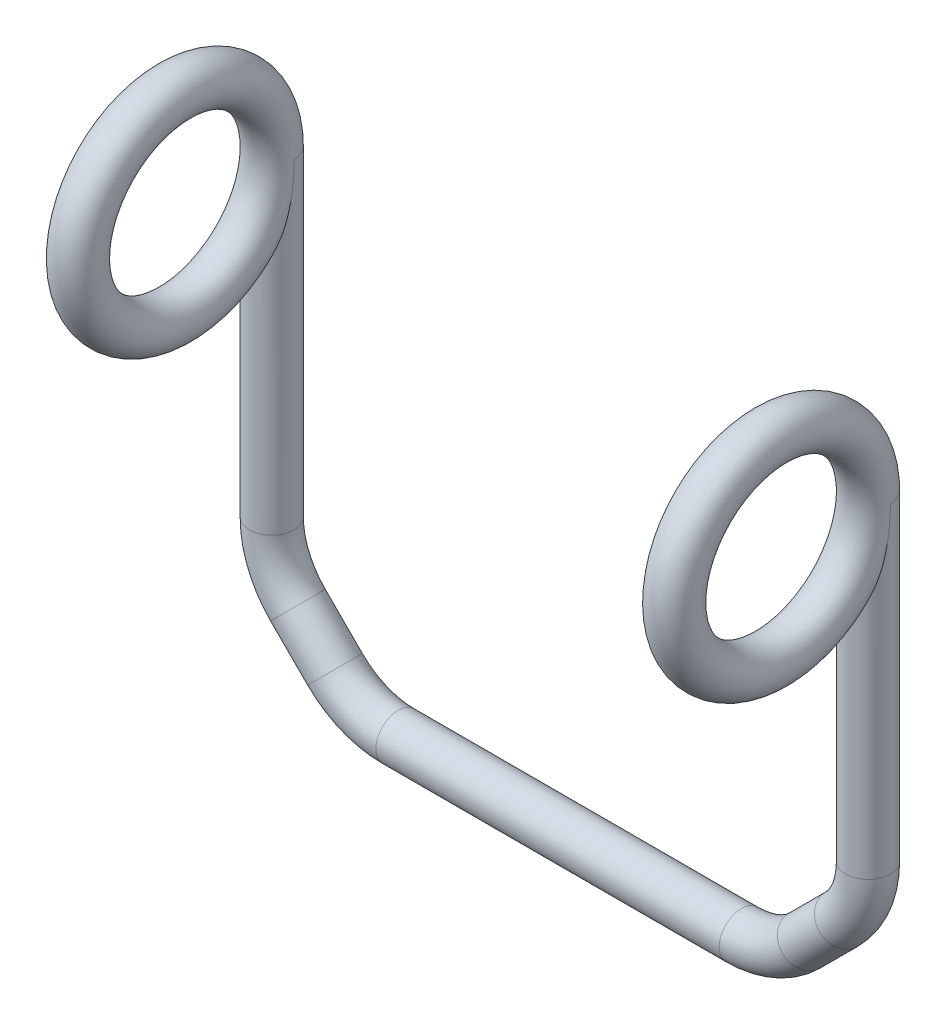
SolidWorks part; units mm, degrees
ref_plane "Front" through (0, 0, 0) normal (0, 0, 1) x (1, 0, 0)
ref_plane "Top" through (0, 0, 0) normal (0, 1, 0) x (1, 0, 0)
ref_plane "Right" through (0, 0, 0) normal (1, 0, 0) x (0, 0, -1)
sketch "Sketch3" plane through (0, 0, 0) normal (0, 0, 1) x (1, 0, 0)
  line L0 (0, 0) -> (0, 93.5789) construction
  line L1 (0, 0) -> (5.7574, 0)
  line L2 (7.8787, 0.8787) -> (9.1213, 2.1213)
  line L3 (10, 4.2426) -> (10, 15)
  arc A0 (9.1213, 2.1213) -> (10, 4.2426) centre (7, 4.2426) ccw
  arc A1 (5.7574, 0) -> (7.8787, 0.8787) centre (5.7574, 3) ccw
  point P10 (7, 0)
  dimension "D5" = 3
  dimension "D1" = 45
  dimension "D2" = 20
  dimension "D3" = 15
  dimension "D4" = 7
sketch "Sketch4" plane through (0, 0, 0) normal (1, 0, 0) x (0, 0, -1)
  circle A0 centre (0, 0) radius 0.75
  dimension "D1" = 1.5
sweep "Bent Wire Retainer- Sweep1" add profiles "Sketch4" path "Sketch3"
sketch "Layout for \"Spring\"" plane through (0, 15, 0) normal (0, 1, 0) x (1, 0, 0)
  line L0 (10, -0.75) -> (10, -5.75) construction
  circle A0 centre (10, 0) radius 0.75 construction
  point P5 (10, -3.25)
  dimension "D1" = 5
ref_plane "Spring \"Coil\" Plane" through (0, 0, 3.25) normal (0, 0, 1) x (1, 0, 0)
sketch "Sketch1" plane through (0, 0, 3.25) normal (0, 0, 1) x (1, 0, 0)
  line L0 (10, 17.5) -> (10, 12.5) construction
  line L1 (10, 18.25) -> (14, 18.25) construction
  line L4 (10, 15) -> (17.8378, 15) construction
  circle A0 centre (10, 18.25) radius 0.75
  dimension "D1" = 5
  dimension "D2" = 1.5
revolve "\"Spring\" Coil- Revolve1" add sketch "Sketch1" angle 360 about L4
mirror "Mirror1" about plane through (0, 0, 0) normal (1, 0, 0)
